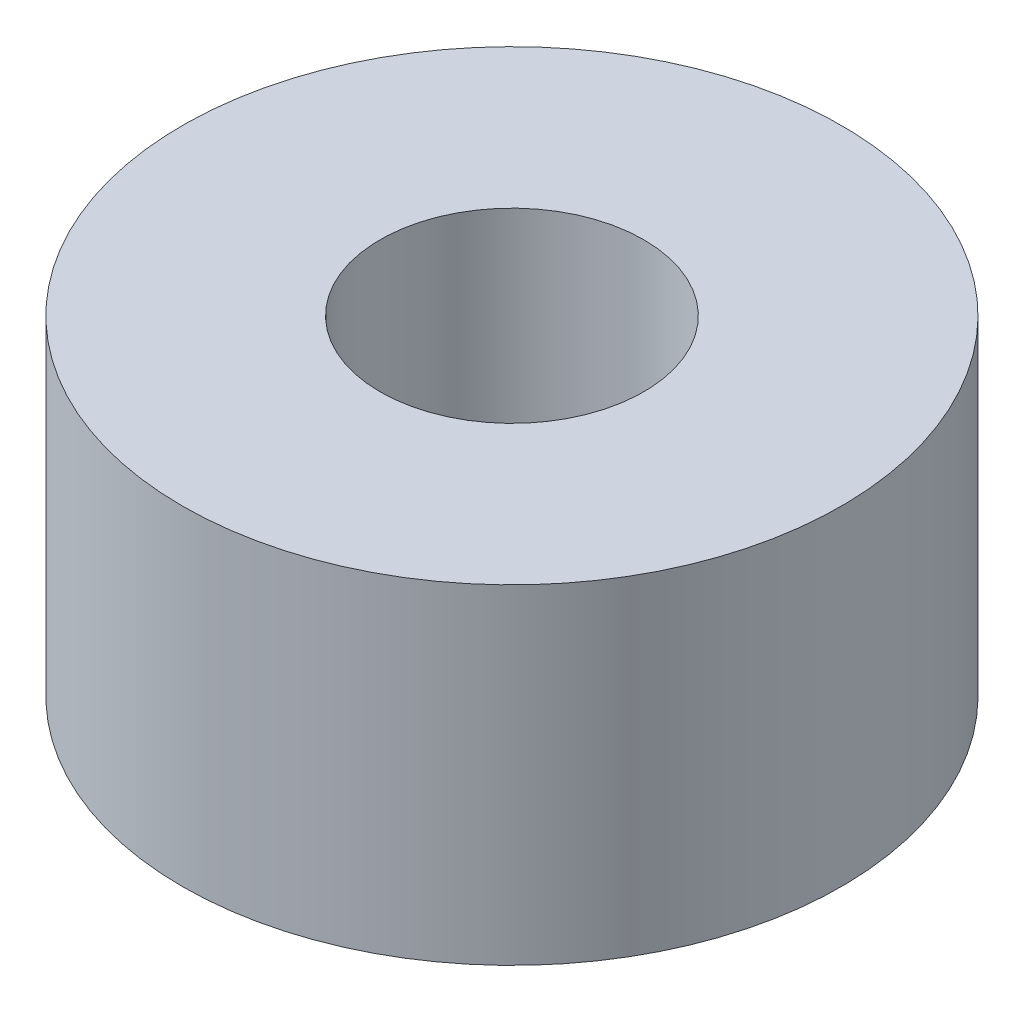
SolidWorks part; units mm, degrees
ref_plane "Front Plane" through (0, 0, 0) normal (0, 0, 1) x (1, 0, 0)
ref_plane "Top Plane" through (0, 0, 0) normal (0, 1, 0) x (1, 0, 0)
ref_plane "Right Plane" through (0, 0, 0) normal (1, 0, 0) x (0, 0, -1)
sketch "Sketch1" plane through (0, 0, 0) normal (0, 1, 0) x (1, 0, 0)
  circle A0 centre (0, 0) radius 20
  dimension "D1" = 40
extrude "Boss-Extrude1" add sketch "Sketch1" along normal blind 20
sketch "Sketch2" plane through (0, 20, 0) normal (0, 1, 0) x (1, 0, 0)
  circle A0 centre (0, 0) radius 8
  dimension "D1" = 16
extrude "Cut-Extrude1" cut sketch "Sketch2" against normal through all
